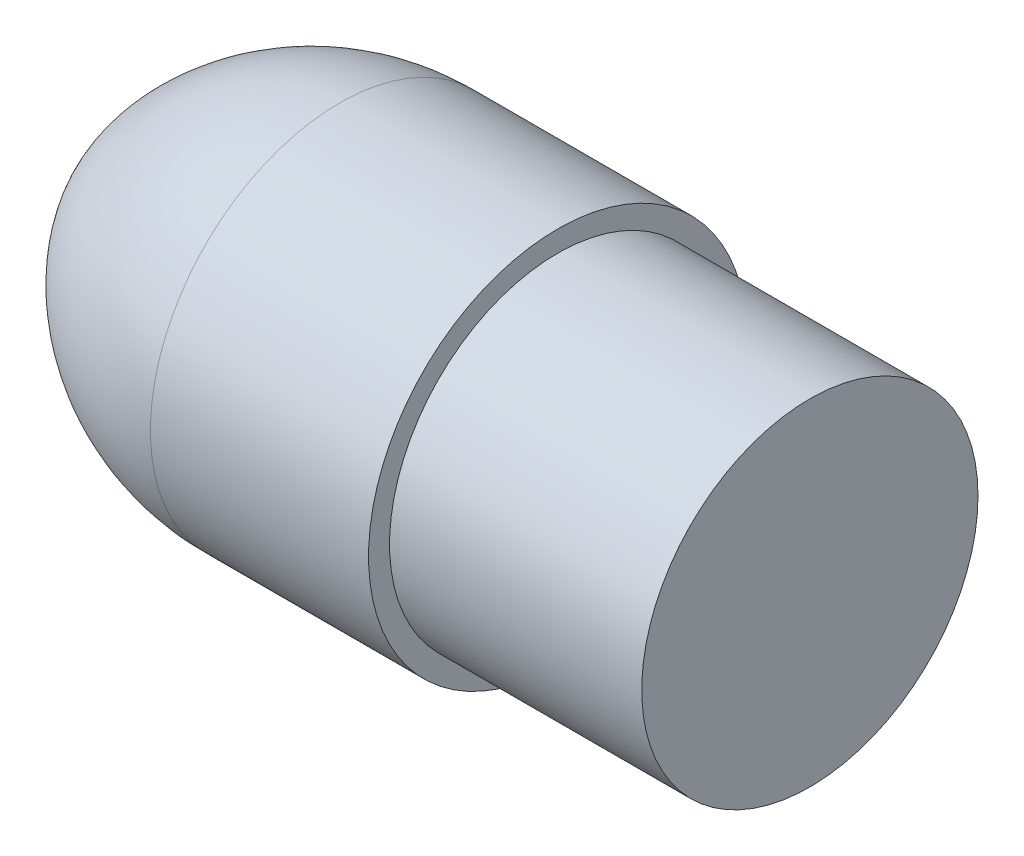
SolidWorks part; units mm, degrees
ref_plane "Front Plane" through (0, 0, 0) normal (0, 0, 1) x (1, 0, 0)
ref_plane "Top Plane" through (0, 0, 0) normal (0, 1, 0) x (1, 0, 0)
ref_plane "Right Plane" through (0, 0, 0) normal (1, 0, 0) x (0, 0, -1)
sketch "Sketch1" plane through (0, 0, 0) normal (0, 0, 1) x (1, 0, 0)
  line L0 (4.9435, 0) -> (-13.2693, 0) construction
  line L1 (0, 0) -> (0, 2.54)
  line L2 (0, 2.54) -> (-3.81, 2.54)
  line L3 (-3.81, 2.54) -> (-3.81, 2.8575)
  line L4 (-3.81, 2.8575) -> (-7.106, 2.8575)
  line L5 (0, 0) -> (-10.795, 0)
  arc A0 (-7.106, 2.8575) -> (-10.795, 0) centre (-7.106, -0.9525) ccw
  dimension "D5" = 3.81
  dimension "D1" = 5.08
  dimension "D2" = 5.715
  dimension "D3" = 6.985
  dimension "D4" = 3.81
revolve "Revolve1" add sketch "Sketch1" angle 360 about L0
